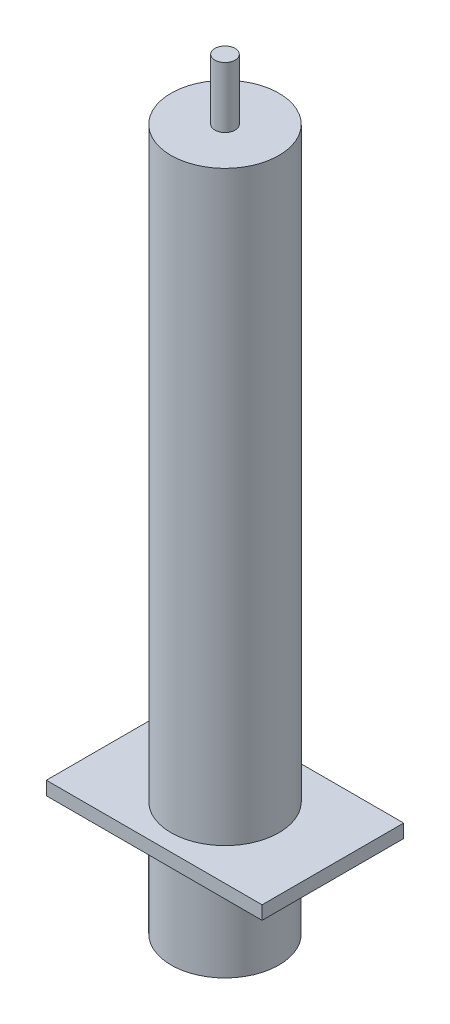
SolidWorks part; units mm, degrees
ref_plane "前视基准面" through (0, 0, 0) normal (0, 0, 1) x (1, 0, 0)
ref_plane "上视基准面" through (0, 0, 0) normal (0, 1, 0) x (1, 0, 0)
ref_plane "右视基准面" through (0, 0, 0) normal (1, 0, 0) x (0, 0, -1)
other "Configuration Table"
sketch "草图1" plane through (0, 0, 0) normal (0, 1, 0) x (1, 0, 0)
  circle A0 centre (0, 0) radius 8
extrude "凸台-拉伸1" add sketch "草图1" along normal blind 75
sketch "草图2" plane through (0, 75, 0) normal (0, 1, 0) x (1, 0, 0)
  circle A0 centre (0, 0) radius 1.6
extrude "凸台-拉伸2" add sketch "草图2" along normal blind 9
sketch "草图3" plane through (0, 0, 0) normal (0, -1, 0) x (1, 0, 0)
  line L1 (-16, -10.5) -> (16, -10.5)
  line L2 (-16, -10.5) -> (-16, 10.5)
  line L3 (-16, 10.5) -> (16, 10.5)
  line L4 (16, -10.5) -> (16, 10.5)
  line L5 (-16, -10.5) -> (16, 10.5) construction
  line L6 (-16, 10.5) -> (16, -10.5) construction
  point P0 (0, 0)
  dimension "D1" = 32
  dimension "D2" = 21
extrude "凸台-拉伸3" add sketch "草图3" along normal blind 2
sketch "草图4" plane through (0, -2, 0) normal (0, -1, 0) x (1, 0, 0)
  circle A0 centre (0, 0) radius 8
extrude "凸台-拉伸4" add sketch "草图4" along normal blind 15
sketch "草图5" plane through (0, 75, 0) normal (0, 1, 0) x (1, 0, 0)
  circle A0 centre (0, 0) radius 8
extrude "凸台-拉伸5" add sketch "草图5" along normal blind 12
sketch "草图6" plane through (0, 87, 0) normal (0, 1, 0) x (1, 0, 0)
  circle A0 centre (0, 0) radius 1.5
extrude "凸台-拉伸6" add sketch "草图6" along normal blind 9
